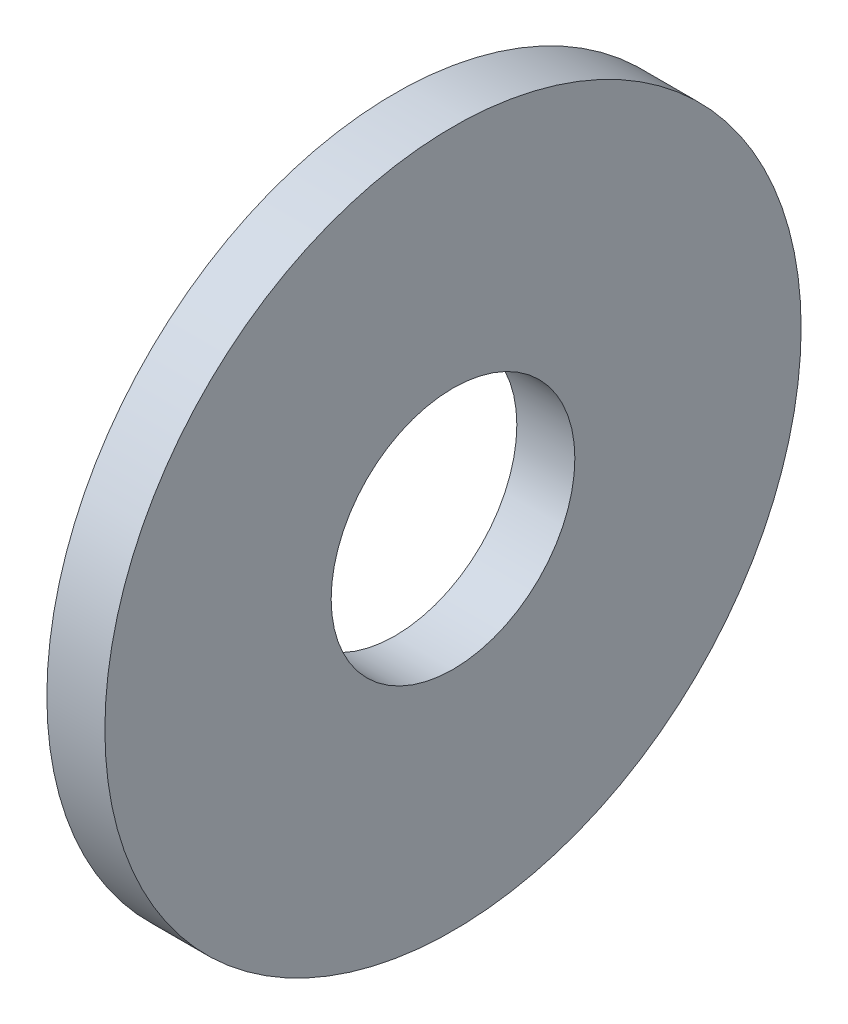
SolidWorks part; units mm, degrees
ref_plane "Plan de face" through (0, 0, 0) normal (0, 0, 1) x (1, 0, 0)
ref_plane "Plan de dessus" through (0, 0, 0) normal (0, 1, 0) x (1, 0, 0)
ref_plane "Plan de droite" through (0, 0, 0) normal (1, 0, 0) x (0, 0, -1)
sketch "Esquisse2" plane through (0, 0, 0) normal (0, 0, 1) x (1, 0, 0)
  line L0 (-7.4558, 0) -> (12.2905, 0) construction
  line L1 (2, 4.2) -> (2, 12)
  line L2 (2, 12) -> (0, 12)
  line L3 (0, 12) -> (0, 4.2)
  line L4 (0, 4.2) -> (2, 4.2)
  dimension "D1" = 12
  dimension "D2" = 4.2
  dimension "Thickness" = 2
revolve "Révolution1" add sketch "Esquisse2" angle 360 about L0
